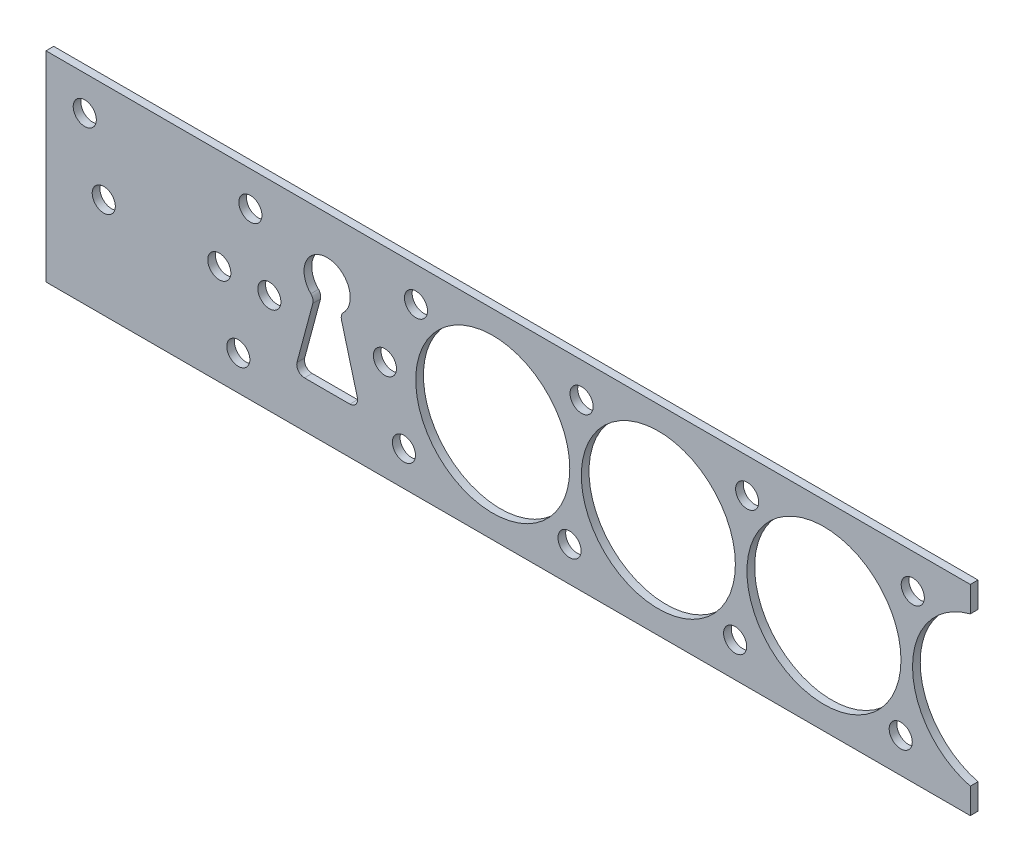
SolidWorks part; units mm, degrees
ref_plane "Plan de face" through (0, 0, 0) normal (0, 0, 1) x (1, 0, 0)
ref_plane "Plan de dessus" through (0, 0, 0) normal (0, 1, 0) x (1, 0, 0)
ref_plane "Plan de droite" through (0, 0, 0) normal (1, 0, 0) x (0, 0, -1)
sketch "Esquisse1" plane through (0, 0, 0) normal (0, 0, 1) x (1, 0, 0)
  line L0 (-15, -13) -> (105, -13) construction
  line L1 (105, 13) -> (105, -13) construction
  line L2 (-15, 13) -> (105, 13) construction
  line L3 (-15, 13) -> (-15, -13) construction
  line L4 (-15, -13) -> (105, -13)
  line L5 (105, 13) -> (105, 9.6825)
  line L6 (-15, 13) -> (105, 13)
  line L7 (-15, 13) -> (-15, -13)
  line L8 (19.6375, 1.9128) -> (17.5866, -5.7412) construction
  line L9 (18.5526, -7) -> (24.4474, -7) construction
  line L10 (25.4134, -5.7412) -> (23.3625, 1.9128) construction
  line L11 (19.6375, 1.9128) -> (17.5866, -5.7412)
  line L12 (18.5526, -7) -> (24.4474, -7)
  line L13 (25.4134, -5.7412) -> (23.3625, 1.9128)
  line L14 (105, -9.6825) -> (105, -13)
  line L19 (-9.9679, 8.5) -> (11.5321, 8.5) construction
  line L20 (11.5321, 8.5) -> (33.0321, 8.5) construction
  line L21 (-7.5, 0) -> (14, 0) construction
  line L25 (43, 0) -> (64.5, 0) construction
  line L26 (6.5, -13) -> (126.5, -13)
  line L27 (28, -13) -> (148, -13)
  line L28 (49.5, -13) -> (169.5, -13)
  line L29 (71, -13) -> (191, -13)
  line L30 (92.5, -13) -> (212.5, -13)
  line L31 (6.5, -13) -> (126.5, -13)
  line L32 (28, -13) -> (148, -13)
  line L33 (49.5, -13) -> (169.5, -13)
  circle A0 centre (-9.9679, 8.5) radius 1.5 construction
  circle A1 centre (9.9679, -8.5) radius 1.5 construction
  circle A2 centre (-9.9679, 8.5) radius 1.5
  circle A3 centre (9.9679, -8.5) radius 1.5
  circle A4 centre (43, 0) radius 10 construction
  circle A5 centre (43, 0) radius 10
  arc A6 (23.6213, 2.8787) -> (19.3787, 2.8787) centre (21.5, 5) ccw construction
  arc A7 (19.6375, 1.9128) -> (19.3787, 2.8787) centre (18.6716, 2.1716) ccw construction
  arc A8 (17.5866, -5.7412) -> (18.5526, -7) centre (18.5526, -6) ccw construction
  arc A9 (24.4474, -7) -> (25.4134, -5.7412) centre (24.4474, -6) ccw construction
  arc A10 (23.6213, 2.8787) -> (23.3625, 1.9128) centre (24.3284, 2.1716) ccw construction
  arc A11 (23.6213, 2.8787) -> (19.3787, 2.8787) centre (21.5, 5) ccw
  arc A12 (19.6375, 1.9128) -> (19.3787, 2.8787) centre (18.6716, 2.1716) ccw
  arc A13 (17.5866, -5.7412) -> (18.5526, -7) centre (18.5526, -6) ccw
  arc A14 (24.4474, -7) -> (25.4134, -5.7412) centre (24.4474, -6) ccw
  arc A15 (23.6213, 2.8787) -> (23.3625, 1.9128) centre (24.3284, 2.1716) ccw
  circle A16 centre (-7.5, 0) radius 1.5 construction
  circle A17 centre (7.5, 0) radius 1.5 construction
  circle A18 centre (-7.5, 0) radius 1.5
  circle A19 centre (7.5, 0) radius 1.5
  circle A20 centre (11.5321, 8.5) radius 1.5
  circle A21 centre (31.4679, -8.5) radius 1.5
  circle A22 centre (33.0321, 8.5) radius 1.5
  circle A23 centre (52.9679, -8.5) radius 1.5
  circle A24 centre (54.5321, 8.5) radius 1.5
  circle A25 centre (74.4679, -8.5) radius 1.5
  circle A26 centre (76.0321, 8.5) radius 1.5
  circle A27 centre (95.9679, -8.5) radius 1.5
  circle A28 centre (97.5321, 8.5) radius 1.5
  circle A30 centre (14, 0) radius 1.5
  circle A31 centre (29, 0) radius 1.5
  circle A32 centre (64.5, 0) radius 10
  circle A33 centre (86, 0) radius 10
  arc A34 (105, 9.6825) -> (105, -9.6825) centre (107.5, 0) ccw
  circle A35 centre (117.4679, -8.5) radius 1.5
  dimension "D2" = 21.5
  dimension "D4" = 21.5
  dimension "D6" = 21.5
  dimension "D1" = 6
  dimension "D3" = 2
  dimension "D5" = 4
extrude "Boss.-Extru.1" add sketch "Esquisse1" along normal up to surface (1 mm away)
